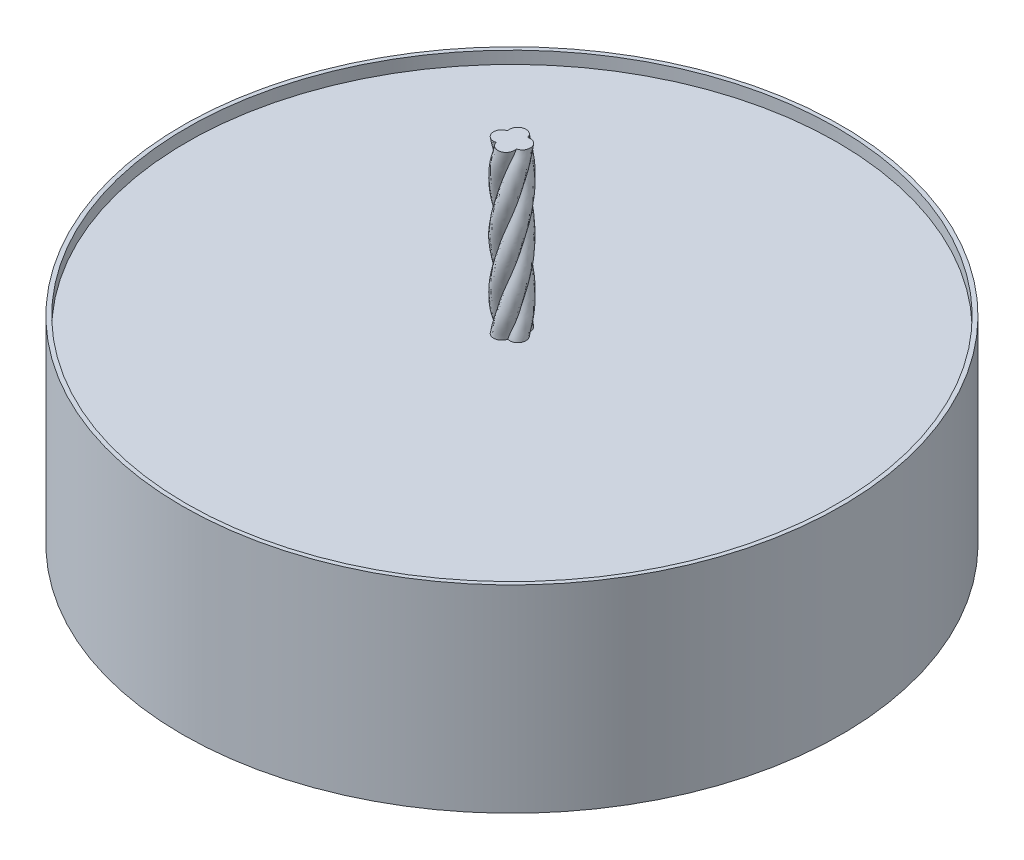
SolidWorks part; units mm, degrees
ref_plane "Front Plane" through (0, 0, 0) normal (0, 0, 1) x (1, 0, 0)
ref_plane "Top Plane" through (0, 0, 0) normal (0, 1, 0) x (1, 0, 0)
ref_plane "Right Plane" through (0, 0, 0) normal (1, 0, 0) x (0, 0, -1)
sketch "Sketch1" plane through (0, 0, 0) normal (0, 1, 0) x (1, 0, 0)
  circle A0 centre (0, 0) radius 20
extrude "Boss-Extrude1" add sketch "Sketch1" along normal blind 12
shell "Shell1" thickness 0.25
sketch "Sketch2" plane through (0, 0.25, 0) normal (0, 1, 0) x (1, 0, 0)
  circle A1 centre (0, 0) radius 19.75
  circle A2 centre (0, 0) radius 19.75
  dimension "D1" = 0
extrude "Boss-Extrude2" add sketch "Sketch2" along normal blind 11 separate body
sketch "Sketch3" plane through (0, 11.25, 0) normal (0, 1, 0) x (1, 0, 0)
  line L0 (0, 0) -> (0.3536, 0.3536) construction
  arc A0 (0.7071, 0) -> (0, 0.7071) centre (0.3536, 0.3536) ccw
  arc A1 (0, -0.7071) -> (0.7071, 0) centre (0.3536, -0.3536) ccw
  arc A2 (-0.7071, 0) -> (0, -0.7071) centre (-0.3536, -0.3536) ccw
  arc A3 (0, 0.7071) -> (-0.7071, 0) centre (-0.3536, 0.3536) ccw
  dimension "D1" = 4
extrude "Boss-Extrude3" add sketch "Sketch3" along normal blind 10 separate body
other "Flex1" parameters "D0"=300, "D1"=0, "D2"=0
